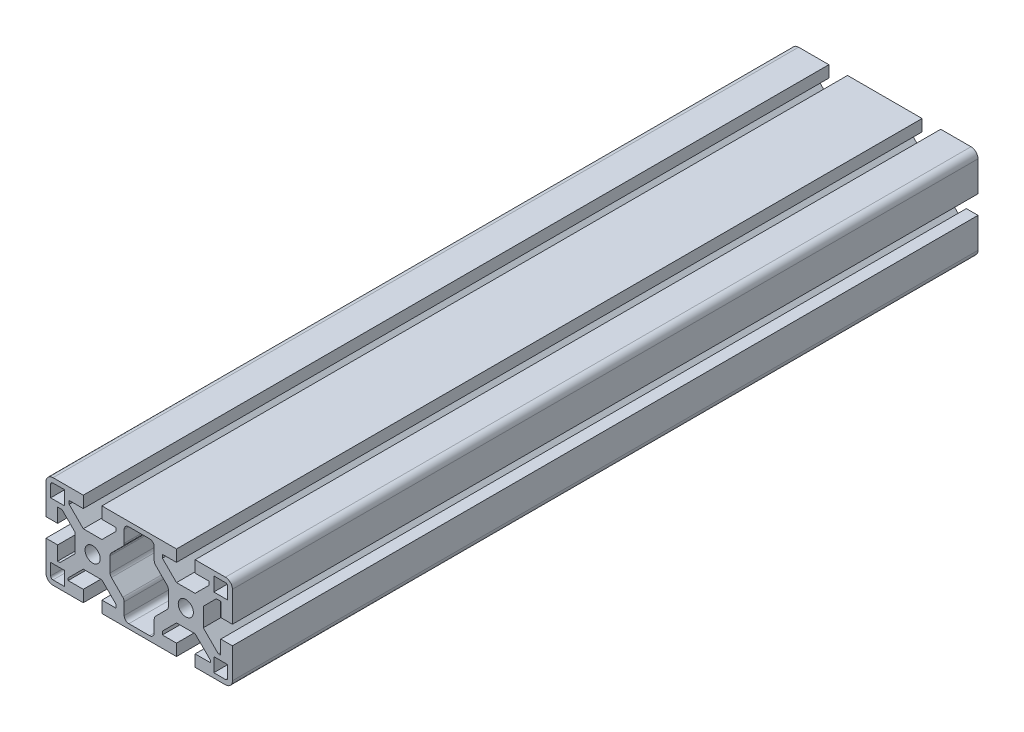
SolidWorks part; units mm, degrees
ref_plane "Alzado" through (0, 0, 0) normal (0, 0, 1) x (1, 0, 0)
ref_plane "Planta" through (0, 0, 0) normal (0, 1, 0) x (1, 0, 0)
ref_plane "Vista lateral" through (0, 0, 0) normal (1, 0, 0) x (0, 0, -1)
sketch "Croquis1" plane through (0, 0, 0) normal (0, 0, 1) x (1, 0, 0)
  line L0 (-18, 12) -> (-12, 12)
  line L1 (-12, 12) -> (-12, 18)
  line L2 (-17, 18) -> (-12, 18)
  line L3 (-18, 12) -> (-18, 17)
  line L4 (24.45, 18) -> (15.55, 18)
  line L5 (31.9142, 4.5858) -> (27.0358, 9.4642)
  line L6 (31.9142, -4.5858) -> (27.0358, -9.4642)
  line L7 (50.0629, 13.55) -> (50.0629, 15)
  line L8 (-17, -18) -> (-12, -18)
  line L9 (-12, -18) -> (-12, -12)
  line L10 (-18, -12) -> (-12, -12)
  line L11 (-18, -17) -> (-18, -12)
  line L12 (50.0629, 13.55) -> (44, 7.5)
  line L13 (50.0629, 15) -> (44, 15)
  line L14 (29.95, 13.55) -> (29.95, 15)
  line L15 (36, 7.5) -> (29.95, 13.55)
  line L16 (-4, 7.5) -> (4, 7.5)
  line L17 (-17, 20) -> (-4, 20)
  line L18 (-7.5, -3.55) -> (-7.5, 4.45)
  line L19 (-4, -7.5) -> (4, -7.5)
  line L20 (7.5, -3.1716) -> (7.5, 3.1716)
  line L21 (36, 15) -> (29.95, 15)
  line L22 (4, 20) -> (4, 15)
  line L23 (55, 10.05) -> (53.1, 10.05)
  line L24 (4, 20) -> (36, 20)
  line L25 (-17, -20) -> (-4, -20)
  line L26 (-4, -20) -> (-4, -15)
  line L27 (36, -20) -> (4, -20)
  line L28 (-15, -10.05) -> (-15, -4)
  line L29 (-20, 4) -> (-20, 17)
  line L30 (-20, -17) -> (-20, -4)
  line L31 (-20, -4) -> (-15, -4)
  line L32 (4, -20) -> (4, -15)
  line L33 (-4, 20) -> (-4, 15)
  line L34 (47.5, 4.45) -> (53.1, 10.05)
  line L35 (55, 4) -> (55, 10.05)
  line L36 (60, 4) -> (55, 4)
  line L37 (4, -15) -> (10.05, -15)
  line L38 (-10.5, -15) -> (-4, -15)
  line L39 (-10.5, -14) -> (-4, -7.5)
  line L40 (-10.5, -14) -> (-10.5, -15)
  line L41 (4, -7.5) -> (10.05, -13.55)
  line L42 (10.05, -15) -> (10.05, -13.55)
  line L43 (-7.5, -3.55) -> (-14, -10.05)
  line L44 (-15, -10.05) -> (-14, -10.05)
  line L45 (-20, 4) -> (-15, 4)
  line L46 (-15, 4) -> (-15, 10.05)
  line L47 (-7.5, 4.45) -> (-13.1, 10.05)
  line L48 (-15, 10.05) -> (-13.1, 10.05)
  line L49 (4, 15) -> (10.05, 15)
  line L50 (4, 7.5) -> (10.05, 13.55)
  line L51 (10.05, 13.55) -> (10.05, 15)
  line L52 (-10.0629, 15) -> (-4, 15)
  line L53 (-10.0629, 13.55) -> (-4, 7.5)
  line L54 (-10.0629, 13.55) -> (-10.0629, 15)
  line L55 (55, -10.05) -> (54, -10.05)
  line L56 (47.5, -3.55) -> (54, -10.05)
  line L57 (8.0858, -4.5858) -> (12.9642, -9.4642)
  line L58 (29.95, -15) -> (29.95, -13.55)
  line L59 (8.0858, 4.5858) -> (12.9642, 9.4642)
  line L60 (36, -7.5) -> (29.95, -13.55)
  line L61 (50.5, -14) -> (50.5, -15)
  line L62 (50.5, -14) -> (44, -7.5)
  line L63 (50.5, -15) -> (44, -15)
  line L64 (36, -15) -> (29.95, -15)
  line L65 (44, 20) -> (44, 15)
  line L66 (36, -20) -> (36, -15)
  line L67 (60, -4) -> (55, -4)
  line L68 (60, -17) -> (60, -4)
  line L69 (60, 4) -> (60, 17)
  line L70 (55, -10.05) -> (55, -4)
  line L71 (44, -20) -> (44, -15)
  line L72 (57, -20) -> (44, -20)
  line L73 (36, 20) -> (36, 15)
  line L74 (32.5, -3.1716) -> (32.5, 3.1716)
  line L75 (44, -7.5) -> (36, -7.5)
  line L76 (47.5, -3.55) -> (47.5, 4.45)
  line L77 (57, 20) -> (44, 20)
  line L78 (44, 7.5) -> (36, 7.5)
  line L79 (58, -17) -> (58, -12)
  line L80 (58, -12) -> (52, -12)
  line L81 (52, -18) -> (52, -12)
  line L82 (57, -18) -> (52, -18)
  line L83 (58, 12) -> (58, 17)
  line L84 (57, 18) -> (52, 18)
  line L85 (52, 12) -> (52, 18)
  line L86 (58, 12) -> (52, 12)
  line L87 (13.55, 10.8784) -> (13.55, 16)
  line L88 (26.45, 10.8784) -> (26.45, 16)
  line L89 (24.45, -18) -> (15.55, -18)
  line L90 (13.55, -10.8784) -> (13.55, -16)
  line L91 (26.45, -10.8784) -> (26.45, -16)
  arc A0 (-18, 17) -> (-17, 18) centre (-17, 17) cw
  arc A1 (57, -20) -> (60, -17) centre (57, -17) ccw
  arc A2 (-18, -17) -> (-17, -18) centre (-17, -17) ccw
  arc A3 (60, 17) -> (57, 20) centre (57, 17) ccw
  circle A4 centre (0, 0) radius 3.25
  circle A5 centre (40, 0) radius 3.25
  arc A6 (-20, 17) -> (-17, 20) centre (-17, 17) cw
  arc A7 (-17, -20) -> (-20, -17) centre (-17, -17) cw
  arc A8 (58, -17) -> (57, -18) centre (57, -17) cw
  arc A9 (58, 17) -> (57, 18) centre (57, 17) ccw
  arc A10 (13.55, 16) -> (15.55, 18) centre (15.55, 16) cw
  arc A11 (12.9642, 9.4642) -> (13.55, 10.8784) centre (11.55, 10.8784) ccw
  arc A12 (7.5, 3.1716) -> (8.0858, 4.5858) centre (9.5, 3.1716) cw
  arc A13 (8.0858, -4.5858) -> (7.5, -3.1716) centre (9.5, -3.1716) cw
  arc A14 (13.55, -10.8784) -> (12.9642, -9.4642) centre (11.55, -10.8784) ccw
  arc A15 (15.55, -18) -> (13.55, -16) centre (15.55, -16) cw
  arc A16 (26.45, -16) -> (24.45, -18) centre (24.45, -16) cw
  arc A17 (32.5, -3.1716) -> (31.9142, -4.5858) centre (30.5, -3.1716) cw
  arc A18 (26.45, -10.8784) -> (27.0358, -9.4642) centre (28.45, -10.8784) cw
  arc A19 (26.45, 16) -> (24.45, 18) centre (24.45, 16) ccw
  arc A20 (26.45, 10.8784) -> (27.0358, 9.4642) centre (28.45, 10.8784) ccw
  arc A21 (32.5, 3.1716) -> (31.9142, 4.5858) centre (30.5, 3.1716) ccw
  point P115 (13.55, 10.05)
  point P118 (7.5, 4)
  point P121 (7.5, -4)
  point P124 (13.55, -10.05)
extrude "Extruir5" add sketch "Croquis1" along normal blind 320
